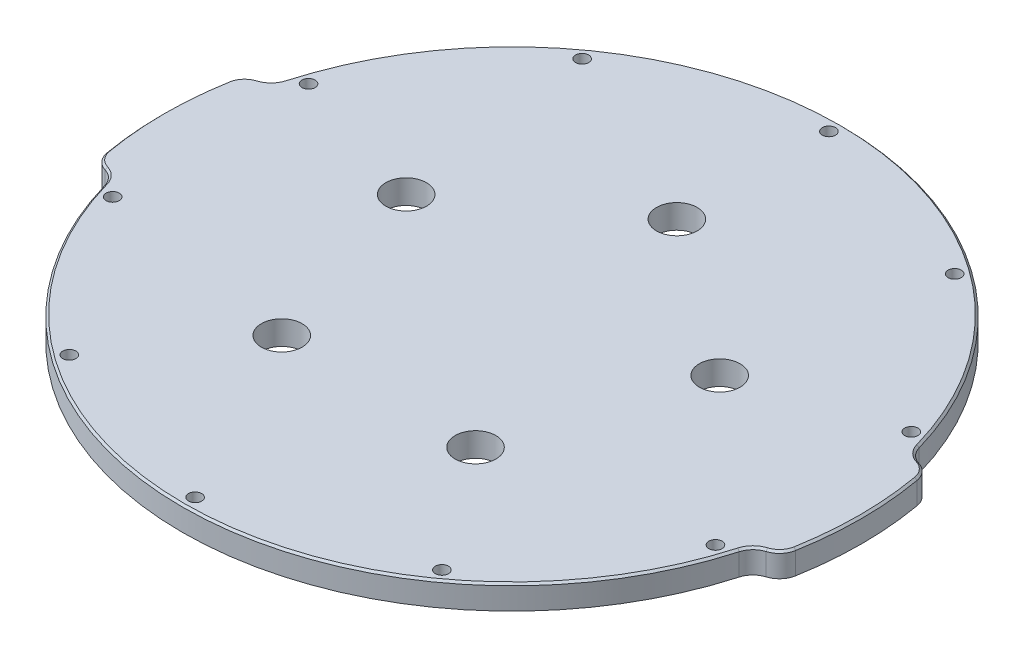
SolidWorks part; units mm, degrees
other "<WTE6-M-END-CAP-5-HOLE-R1>-<Chamfer1>"
ref_plane "Front Plane" through (0, 0, 0) normal (0, 0, 1) x (1, 0, 0)
ref_plane "Top Plane" through (0, 0, 0) normal (0, 1, 0) x (1, 0, 0)
ref_plane "Right Plane" through (0, 0, 0) normal (1, 0, 0) x (0, 0, -1)
inserted part "WTE6-M-END-CAP-5-HOLE-R1"
